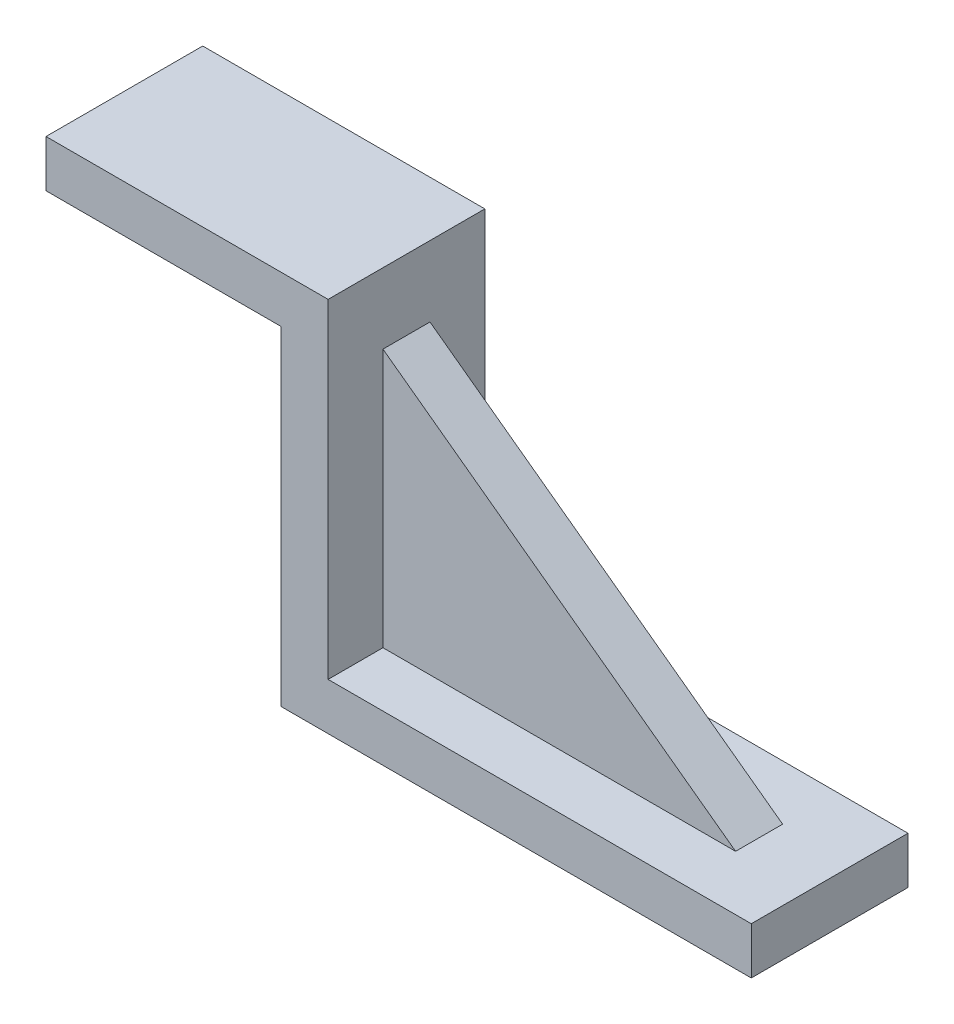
SolidWorks part; units mm, degrees
ref_plane "Front Plane" through (0, 0, 0) normal (0, 0, 1) x (1, 0, 0)
ref_plane "Top Plane" through (0, 0, 0) normal (0, 1, 0) x (1, 0, 0)
ref_plane "Right Plane" through (0, 0, 0) normal (1, 0, 0) x (0, 0, -1)
sketch "Sketch1" plane through (0, 0, 0) normal (0, 0, 1) x (1, 0, 0)
  line L0 (0, 0) -> (-20, 0)
  line L1 (-20, 0) -> (-20, 14)
  line L2 (-20, 14) -> (-30, 14)
  dimension "D1" = 10
  dimension "D2" = 14
  dimension "D3" = 20
extrude "Extrude-Thin1" add sketch "Sketch1" along normal mid plane 6.6667 thin
sketch "Sketch2" plane through (0, 0, 0) normal (0, 0, 1) x (1, 0, 0)
  line L0 (-18, 13) -> (-3, 2)
  line L1 (-18, 2) -> (-18, 16) construction
  line L2 (0, 2) -> (-18, 2) construction
  dimension "Rib" = 3
rib "Rib2" sketch "Sketch2" sketch "Sketch2" thickness 12 extrusion direction parallel to sketch draft on no parameters "With"=12, "Wide"=12
equation "\"D2@Sketch1\" = \"D1@Sketch1\" +4"
equation "\"D1@Extrude-Thin1\" = \"D1@Sketch1\" / 1.5"
equation "\"D1@Sketch1\" = \"D3@Sketch1\"  / 2"
